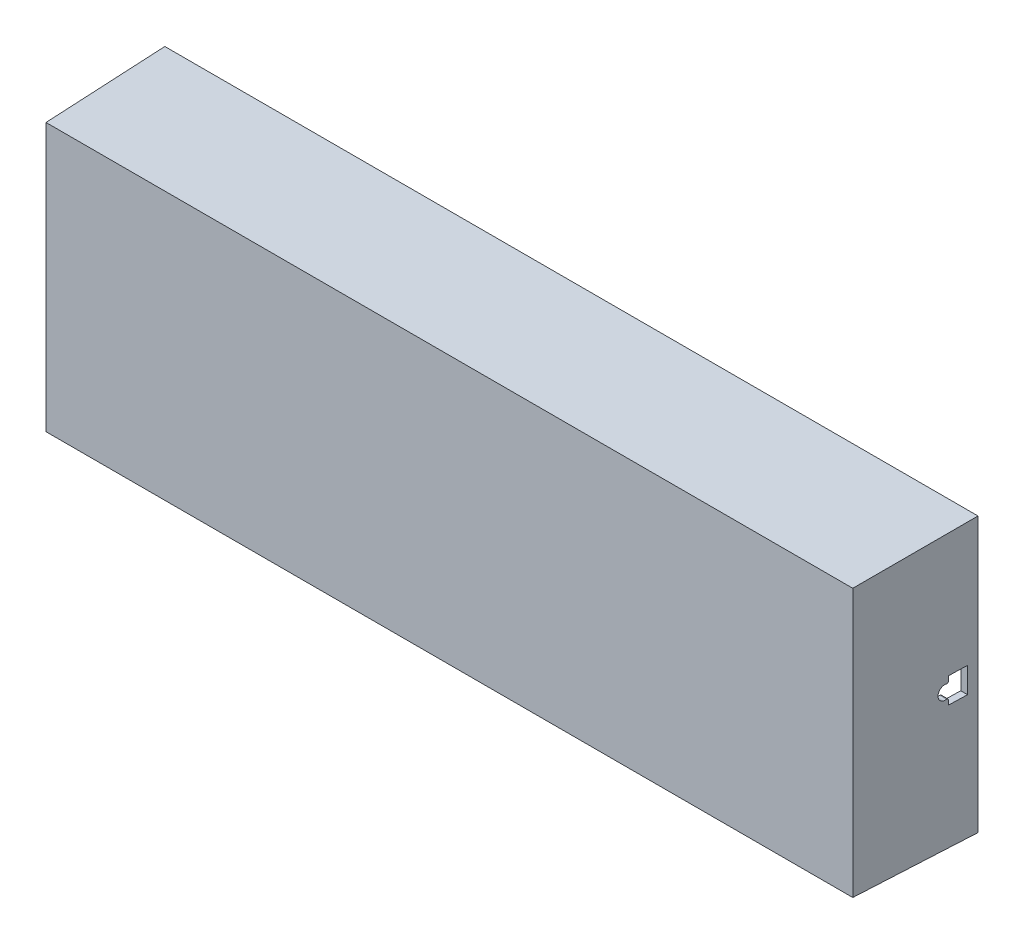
SolidWorks part; units mm, degrees
ref_plane "Plan1" through (0, 0, 0) normal (0, 0, 1) x (1, 0, 0)
ref_plane "Plan2" through (0, 0, 0) normal (0, 1, 0) x (1, 0, 0)
ref_plane "Plan3" through (0, 0, 0) normal (1, 0, 0) x (0, 0, -1)
sketch "Esquisse1" plane through (0, 0, 0) normal (0, 0, 1) x (1, 0, 0)
  line L1 (-119.95, 40.45) -> (119.95, 40.45)
  line L2 (-119.95, 40.45) -> (-119.95, -40.45)
  line L3 (-119.95, -40.45) -> (119.95, -40.45)
  line L4 (119.95, 40.45) -> (119.95, -40.45)
  dimension "D1" = 239.9
  dimension "D2" = 119.95
  dimension "D3" = 80.9
  dimension "D4" = 40.45
extrude "Extrusion1" add sketch "Esquisse1" along normal blind 36 draft 1.5
sketch "Esquisse2" plane through (0, 0, 0) normal (0, 0, -1) x (-1, 0, 0)
  line L0 (-119.95, 40.45) -> (119.95, 40.45) construction
  line L1 (-117.95, 38.45) -> (117.95, 38.45)
  line L2 (-117.95, 38.45) -> (-117.95, -38.45)
  line L3 (-117.95, -38.45) -> (117.95, -38.45)
  line L4 (117.95, 38.45) -> (117.95, -38.45)
  line L5 (119.95, 40.45) -> (119.95, -40.45) construction
  line L6 (119.95, -40.45) -> (-119.95, -40.45) construction
  line L7 (-119.95, -40.45) -> (-119.95, 40.45) construction
  dimension "D1" = 2
  dimension "D2" = 2
  dimension "D3" = 2
  dimension "D4" = 2
extrude "Enlèv. mat.-Extru.1" cut sketch "Esquisse2" against normal blind 34 draft 1.5
sketch "Esquisse3" plane through (0, 0, 0) normal (0, 0, 1) x (1, 0, 0)
  line L0 (117.95, -38.45) -> (-117.95, -38.45) construction
  line L1 (-6.45, -38.45) -> (-34.45, -38.45)
  line L2 (-6.45, -38.45) -> (-6.45, -39.45)
  line L3 (-6.45, -39.45) -> (-34.45, -39.45)
  line L4 (-34.45, -38.45) -> (-34.45, -39.45)
  line L5 (-119.95, 40.45) -> (-119.95, -40.45) construction
  line L6 (0, 0) -> (0, -23.0893) construction
  line L7 (34.45, -38.45) -> (34.45, -39.45)
  line L8 (6.45, -39.45) -> (34.45, -39.45)
  line L9 (6.45, -38.45) -> (6.45, -39.45)
  line L10 (6.45, -38.45) -> (34.45, -38.45)
  line L11 (0, 0) -> (-39.7081, 0) construction
  line L12 (6.45, 38.45) -> (34.45, 38.45)
  line L13 (6.45, 38.45) -> (6.45, 39.45)
  line L14 (6.45, 39.45) -> (34.45, 39.45)
  line L15 (34.45, 38.45) -> (34.45, 39.45)
  line L16 (-34.45, 38.45) -> (-34.45, 39.45)
  line L17 (-6.45, 39.45) -> (-34.45, 39.45)
  line L18 (-6.45, 38.45) -> (-6.45, 39.45)
  line L19 (-6.45, 38.45) -> (-34.45, 38.45)
  dimension "D1" = 1
  dimension "D2" = 28
  dimension "D3" = 113.5
extrude "Extrusion2" add sketch "Esquisse3" against normal blind 1
sketch "Esquisse4" plane through (0, 0, 0) normal (1, 0, 0) x (0, 0, -1)
  line L0 (0, -40.45) -> (0, 40.45) construction
  line L1 (-3, 3.75) -> (-8.5, 3.75)
  line L2 (-3, 3.75) -> (-3, -3.75)
  line L3 (-3, -3.75) -> (-8.5, -3.75)
  line L4 (-8.5, 3.75) -> (-8.5, 2.4495)
  line L6 (-8.5, -2.4495) -> (-8.5, -3.75)
  arc A0 (-9.1, 1.9596) -> (-9.1, -1.9596) centre (-9.5, 0) ccw
  arc A1 (-8.5, 2.4495) -> (-9.1, 1.9596) centre (-9, 2.4495) cw
  arc A2 (-8.5, -2.4495) -> (-9.1, -1.9596) centre (-9, -2.4495) ccw
  point P9 (0, 0)
  dimension "D5" = 4
  dimension "D8" = 0.5
  dimension "D1" = 3
  dimension "D2" = 7.5
  dimension "D3" = 3.75
  dimension "D4" = 5.5
  dimension "D6" = 1
  dimension "D7" = 5.5
extrude "Enlèv. mat.-Extru.3" cut sketch "Esquisse4" against normal mid plane 400
